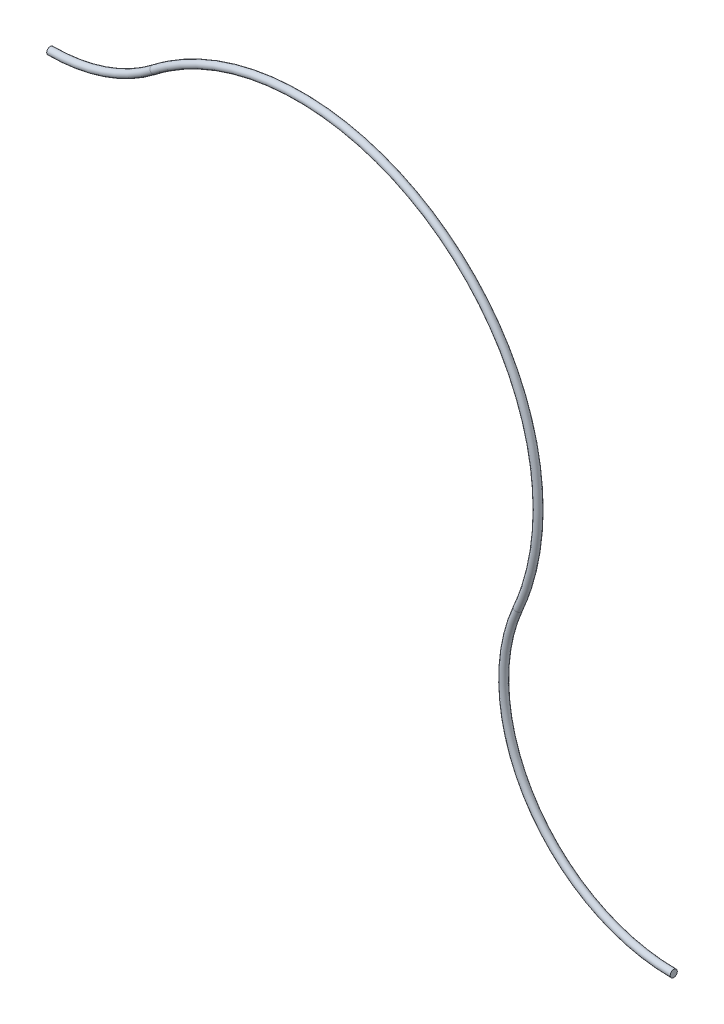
SolidWorks part; units mm, degrees
ref_plane "Front Plane" through (0, 0, 0) normal (0, 0, 1) x (1, 0, 0)
ref_plane "Top Plane" through (0, 0, 0) normal (0, 1, 0) x (1, 0, 0)
ref_plane "Right Plane" through (0, 0, 0) normal (1, 0, 0) x (0, 0, -1)
sketch "Sketch1" plane through (0, 0, 0) normal (0, 0, 1) x (1, 0, 0)
  line L0 (0, 0) -> (-0.4168, 0) construction
  line L1 (0, 0) -> (0, -0.5107) construction
  arc A0 (0, 0) -> (0.4654, 0.1586) centre (0, 0.762) ccw
  arc A1 (0.4654, 0.1586) -> (2.0962, -1.1164) centre (1.1178, -0.6873) cw
  arc A2 (2.0962, -1.1164) -> (2.794, -2.1844) centre (2.794, -1.4224) ccw
  dimension "D1" = 0.381
  dimension "D3" = 0.762
  dimension "D2" = 2.1844
  dimension "D4" = 2.794
sketch "Sketch2" plane through (0, 0, 0) normal (1, 0, 0) x (0, 0, -1)
  circle A0 centre (0, 0) radius 0.0159
  dimension "D1" = 0.0318
sweep "Sweep1" add profiles "Sketch2" path "Sketch1"
